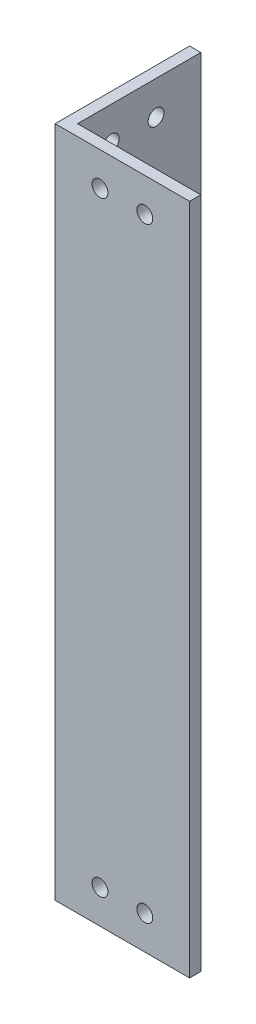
SolidWorks part; units mm, degrees
ref_plane "Front Plane" through (0, 0, 0) normal (0, 0, 1) x (1, 0, 0)
ref_plane "Top Plane" through (0, 0, 0) normal (0, 1, 0) x (1, 0, 0)
ref_plane "Right Plane" through (0, 0, 0) normal (1, 0, 0) x (0, 0, -1)
sketch "Sketch1" plane through (0, 0, 0) normal (0, 1, 0) x (1, 0, 0)
  line L0 (0, 0) -> (0, 38.1)
  line L1 (0, 38.1) -> (3.175, 38.1)
  line L2 (3.175, 38.1) -> (3.175, 3.175)
  line L3 (3.175, 3.175) -> (38.1, 3.175)
  line L4 (38.1, 3.175) -> (38.1, 0)
  line L5 (38.1, 0) -> (0, 0)
  line L6 (0, 0) -> (19.2308, 19.2308) construction
  dimension "D1" = 38.1
  dimension "D2" = 3.175
  dimension "D3" = 38.1
  dimension "D4" = 3.175
extrude "Boss-Extrude1" add sketch "Sketch1" along normal blind 190.5
sketch "Sketch2" plane through (0, 0, 0) normal (0, 0, 1) x (1, 0, 0)
  line L0 (19.05, 0) -> (19.05, 9.525) construction
  line L1 (0, 0) -> (38.1, 0) construction
  line L2 (25.4, 9.525) -> (12.7, 9.525) construction
  line L3 (0, 95.25) -> (38.1, 95.25) construction
  line L4 (0, 190.5) -> (0, 0) construction
  line L5 (38.1, 190.5) -> (38.1, 0) construction
  dimension "D1" = 9.525
  dimension "D2" = 12.7
hole_wizard "#8 Clearance Hole1" positions "Sketch4" profile "Sketch3" hole size "#8" standard "ANSI Inch"
sketch "Sketch4" plane through (0, 0, 0) normal (0, 0, 1) x (1, 0, 0)
  point P0 (12.7, 9.525)
  point P3 (25.4, 9.525)
sketch "Sketch3" plane through (12.7, 9.525, 0) normal (1, 0, 0) x (0, -1, 0)
  line L0 (0, 0) -> (0, 3.176)
  line L1 (0, 3.176) -> (2.2479, 3.176)
  line L2 (2.2479, 3.176) -> (2.2479, 0)
  line L5 (2.2479, 0) -> (0, 0)
  line L11 (0, -6.35) -> (0, 107.95) construction
  dimension "Thru Hole Dia." = 4.4958
  dimension "Thru Hole Depth" = 3.176
ref_plane "Plane1" through (0, 0, 0) normal (-0.7071, 0, -0.7071) x (-0.7071, 0, 0.7071)
mirror "Mirror1" about plane through (0, 0, 0) normal (-0.7071, 0, -0.7071) of "#8 Clearance Hole1"
ref_plane "Plane2" through (0, 95.25, 0) normal (0, -1, 0) x (-1, 0, 0)
mirror "Mirror3" about plane through (0, 95.25, 0) normal (0, -1, 0) of "#8 Clearance Hole1", "Mirror1"
